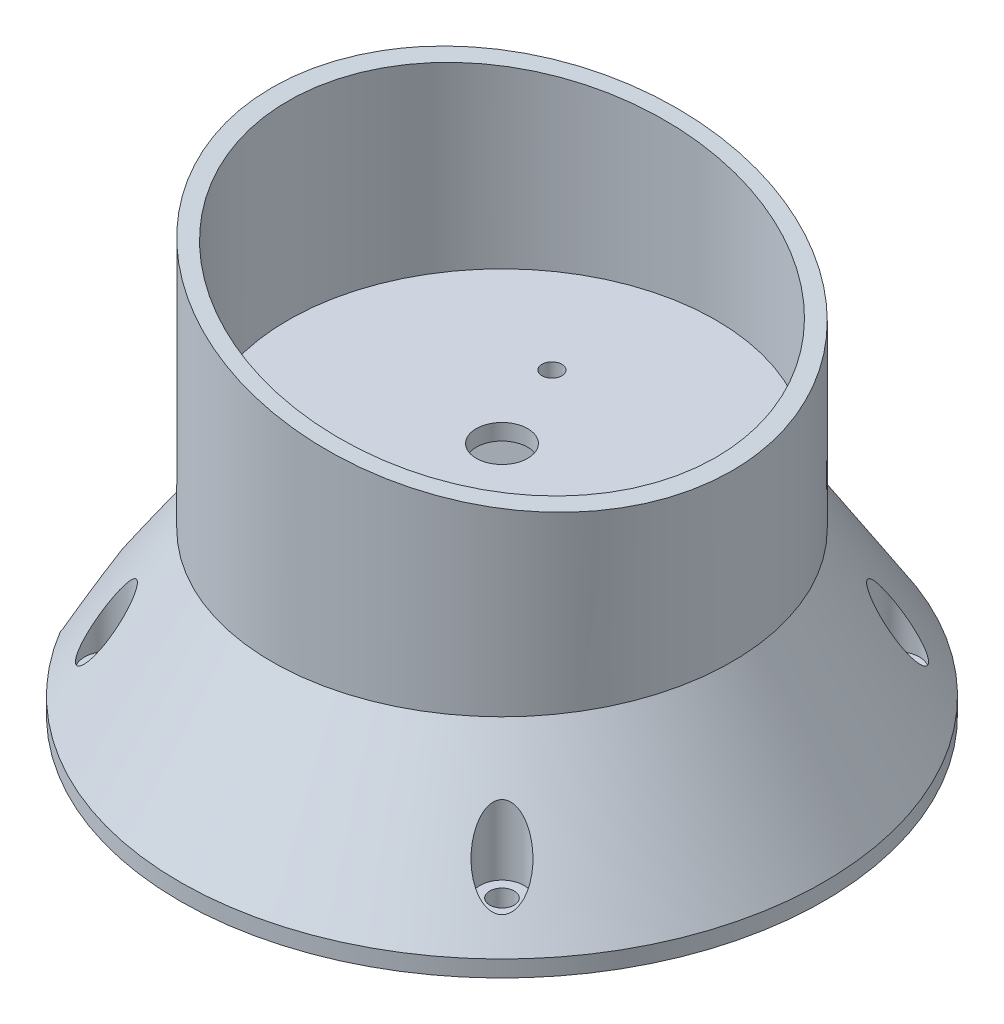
SolidWorks part; units mm, degrees
ref_plane "Front Plane" through (0, 0, 0) normal (0, 0, 1) x (1, 0, 0)
ref_plane "Top Plane" through (0, 0, 0) normal (0, 1, 0) x (1, 0, 0)
ref_plane "Right Plane" through (0, 0, 0) normal (1, 0, 0) x (0, 0, -1)
sketch "Sketch1" plane through (0, 0, 0) normal (0, 1, 0) x (1, 0, 0)
  circle A0 centre (0, 0) radius 42.164
  circle A1 centre (0, 0) radius 5.08
  circle A2 centre (-7.62, 17.4625) radius 1.9685
  circle A3 centre (-7.62, -17.4625) radius 1.9685
  circle A6 centre (0, 0) radius 45.339
  dimension "D1" = 7.62
  dimension "D3" = 34.925
  dimension "D5" = 10.16
  dimension "D7" = 84.328
  dimension "D8" = 3.175
  dimension "D2" = 17.4625
extrude "hopper floor" add sketch "Sketch1" along normal blind 3.175
sketch "Sketch2" plane through (0, 3.175, 0) normal (0, 1, 0) x (1, 0, 0)
  circle A0 centre (0, 0) radius 45.339
  circle A1 centre (0, 0) radius 42.164
  dimension "D1" = 3.175
extrude "hopper walls" add sketch "Sketch2" along normal blind 38.1
sketch "Sketch4" plane through (0, 3.175, 0) normal (0, 1, 0) x (1, 0, 0)
  line L0 (32.7376, -7.8043) -> (41.0147, -9.7775)
  line L1 (33.0929, 6.1252) -> (41.4598, 7.6738)
  arc A0 (33.0929, 6.1252) -> (32.7376, -7.8043) centre (0, 0) cw
  circle A1 centre (0, 0) radius 42.164 construction
  arc A3 (41.0147, -9.7775) -> (41.4598, 7.6738) centre (0, 0) ccw
extrude "drop slot" cut sketch "Sketch4" against normal up to next
chamfer "hopper slot finish" distance 1.27 angle 45 3 edges at (37.2764, 3.175, -6.8995) (33.6441, 3.175, 0.8582) (36.8761, 3.175, 8.7909)
sketch "Sketch6" plane through (0, 0, 0) normal (0, -1, 0) x (1, 0, 0)
  line L0 (28.9203, 9.6253) -> (43.019, 14.3176)
  line L1 (10.16, 22.86) -> (-50.8, 22.86)
  line L2 (10.16, 22.86) -> (10.16, -22.86)
  line L3 (10.16, -22.86) -> (-50.8, -22.86)
  line L4 (-50.8, 22.86) -> (-50.8, -22.86)
  line L5 (29.3734, -8.1383) -> (43.693, -12.1058)
  line L6 (41.0147, 9.7775) -> (32.7376, 7.8043) construction
  line L7 (33.0929, -6.1252) -> (41.4598, -7.6738) construction
  circle A0 centre (0, 0) radius 45.339
  arc A4 (28.9203, 9.6253) -> (29.3734, -8.1383) centre (0, 0) cw
  arc A5 (33.0929, -6.1252) -> (32.7376, 7.8043) centre (0, 0) ccw construction
  dimension "D1" = 10.16
  dimension "D3" = 50.8
  dimension "D4" = 45.72
  dimension "D5" = 3.175
  dimension "D2" = 22.86
  dimension "D6" = 5
  dimension "D7" = 5
extrude "height for motor1" add sketch "Sketch6" along normal blind 29.972 contours A4 L0 L1 L2 L3 L5 M16 | L0 A4 L5 M16 M10 M7 M8 M9
sketch "dropview" plane through (0, -29.972, 0) normal (0, -1, 0) x (1, 0, 0)
  line L0 (41.9041, 4.6746) -> (45.0595, 5.0266)
  line L1 (42.1532, 0.9522) -> (45.329, 0.9522)
  arc A0 (41.4598, -7.6738) -> (41.0147, 9.7775) centre (0, 0) ccw construction
  circle A1 centre (0, 0) radius 45.339 construction
  arc A2 (41.9041, 4.6746) -> (42.1532, 0.9522) centre (0, 0) cw
  arc A3 (45.0595, 5.0266) -> (45.329, 0.9522) centre (0, 0) cw
sketch "Sketch8" plane through (0, -29.972, 0) normal (0, -1, 0) x (1, 0, 0)
  line L0 (32.7376, 7.8043) -> (41.0147, 9.7775)
  line L1 (33.0929, -6.1252) -> (41.4598, -7.6738)
  line L2 (41.4598, -7.6738) -> (33.0929, -6.1252) construction
  circle A0 centre (0, 0) radius 45.339
  arc A1 (41.0147, 9.7775) -> (41.4598, -7.6738) centre (0, 0) cw
  arc A2 (32.7376, 7.8043) -> (33.0929, -6.1252) centre (0, 0) cw
  arc A3 (33.0929, -6.1252) -> (32.7376, 7.8043) centre (0, 0) ccw construction
extrude "top of queue" add sketch "Sketch8" along normal blind 3.175
sketch "Sketch9" plane through (0, -33.147, 0) normal (0, -1, 0) x (1, 0, 0)
  circle A0 centre (0, 0) radius 45.339
  circle A1 centre (0, 0) radius 42.164
  dimension "D1" = 3.175
extrude "queue wall" add sketch "Sketch9" along normal blind 10.033
sketch "Sketch10" plane through (0, -43.18, 0) normal (0, -1, 0) x (1, 0, 0)
  circle A0 centre (0, 0) radius 45.339
  circle A1 centre (0, 0) radius 63.5
  point P0 (0, 0)
extrude "round floor" add sketch "Sketch10" against normal blind 3.175
chamfer "better connection" distance 28.575 angle 32.5 2 edges at (-45.339, -29.972, 0) (0, -40.005, -45.339)
sketch "Sketch13" plane through (0, -43.18, 0) normal (0, -1, 0) x (1, 0, 0)
  line L0 (0, 0) -> (79.4833, 53.827) construction
  line L1 (31.3378, 30.732) -> (33.0203, 31.8714)
  line L2 (31.3378, 30.732) -> (40.1682, 17.6927)
  line L3 (33.0203, 31.8714) -> (41.8507, 18.8321)
  line L4 (40.1682, 17.6927) -> (41.8507, 18.8321)
  line L5 (31.3378, 30.732) -> (41.8507, 18.8321) construction
  line L6 (33.0203, 31.8714) -> (40.1682, 17.6927) construction
  point P5 (36.5942, 24.782)
  dimension "D2" = 44.196
  dimension "D1" = 2.032
  dimension "D3" = 15.748
  dimension "D4" = 7.874
extrude "optical sensor" cut sketch "Sketch13" against normal blind 19.558
sketch "Sketch24" plane through (0, -43.18, 0) normal (0, -1, 0) x (1, 0, 0)
  line L0 (0, 0) -> (52.5779, 35.6064) construction
  line L1 (30.6705, 28.0935) -> (38.0314, 33.0784)
  line L2 (30.6705, 28.0935) -> (37.5069, 17.9985)
  line L3 (38.0314, 33.0784) -> (44.8678, 22.9834)
  line L4 (37.5069, 17.9985) -> (44.8678, 22.9834)
  line L5 (30.6705, 28.0935) -> (44.8678, 22.9834) construction
  line L6 (38.0314, 33.0784) -> (37.5069, 17.9985) construction
  circle A0 centre (0, 0) radius 63.5 construction
  point P6 (37.7692, 25.5385)
  dimension "D1" = 41.148
  dimension "D2" = 8.89
  dimension "D3" = 12.192
  dimension "D4" = 0.0325
extrude "optical wire access" cut sketch "Sketch24" against normal up to surface (19.558 mm away)
sketch "Sketch25" plane through (0, 0, 22.86) normal (0, 0, -1) x (-1, 0, 0)
  line L0 (45.339, 41.275) -> (-45.339, 41.275)
  line L1 (-45.339, 41.275) -> (-45.339, 21.1722)
  line L2 (-45.339, 41.275) -> (-45.339, -11.43) construction
  line L3 (-45.339, 21.1722) -> (45.339, 41.275)
  dimension "D1" = 12.5
extrude "Cut-Extrude11" cut sketch "Sketch25" against normal through all and the other way through all
sketch "Sketch26" plane through (0, -43.18, 0) normal (0, -1, 0) x (1, 0, 0)
  circle A0 centre (39.497, 39.497) radius 2.413
  circle A1 centre (39.497, -38.481) radius 2.413
  circle A2 centre (-38.481, -38.481) radius 2.413
  circle A3 centre (-38.481, 39.497) radius 2.413
extrude "Cut-Extrude12" cut sketch "Sketch26" against normal through all
sketch "Sketch27" plane through (0, 3.175, 0) normal (0, 1, 0) x (1, 0, 0)
  circle A0 centre (39.497, 38.481) radius 4.318
  circle A1 centre (39.497, -39.497) radius 4.318
  circle A2 centre (-38.481, 38.481) radius 4.318
  circle A3 centre (-38.481, -39.497) radius 4.318
extrude "Cut-Extrude13" cut sketch "Sketch27" against normal blind 38.1
sketch "Sketch28" plane through (0, -43.18, 0) normal (0, -1, 0) x (1, 0, 0)
  line L0 (-54.991, -31.7528) -> (-54.991, 31.7528) construction
  line L1 (-54.991, -31.7528) -> (-74.7888, -31.7528)
  line L2 (-54.991, -31.7528) -> (-54.991, 31.7528)
  line L3 (-54.991, 31.7528) -> (-74.7888, 31.7528)
  line L4 (-74.7888, -31.7528) -> (-74.7888, 31.7528)
  circle A0 centre (0, 0) radius 63.5 construction
extrude "Cut-Extrude15" cut sketch "Sketch28" against normal blind 24.13 draft 12.5 contours L4 L3 L2 L1
